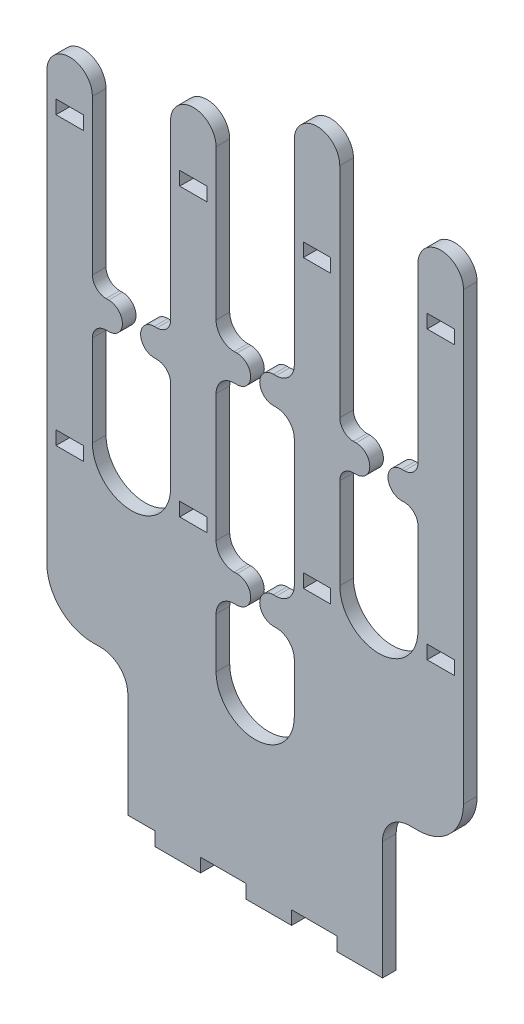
SolidWorks part; units mm, degrees
ref_plane "Front Plane" through (0, 0, 0) normal (0, 0, 1) x (1, 0, 0)
ref_plane "Top Plane" through (0, 0, 0) normal (0, 1, 0) x (1, 0, 0)
ref_plane "Right Plane" through (0, 0, 0) normal (1, 0, 0) x (0, 0, -1)
sketch "Sketch1" plane through (0, 0, 0) normal (0, 0, 1) x (1, 0, 0)
  line L0 (0, 0) -> (-140, 0)
  line L1 (-140, 0) -> (-140, 130)
  line L2 (-170, 160) -> (-179, 160)
  line L6 (-93, 350) -> (-93, 450)
  line L7 (-43, 700) -> (-43, 535)
  line L14 (179, 160) -> (170, 160)
  line L15 (140, 130) -> (140, 0)
  line L16 (140, 0) -> (0, 0)
  line L17 (-229, 210) -> (-229, 680)
  line L19 (-179, 680) -> (-179, 510)
  line L20 (0, -370.316) -> (0, 1299.3214) construction
  line L22 (93, 750) -> (93, 510)
  line L23 (179, 350) -> (179, 450)
  line L24 (229, 700) -> (229, 210)
  line L25 (-164, 495) -> (-161, 495)
  line L26 (-161, 465) -> (-164, 465)
  line L27 (-179, 450) -> (-179, 350)
  line L28 (-136, 849.3239) -> (-136, 130) construction
  line L29 (-111, 465) -> (-108, 465)
  line L30 (-108, 495) -> (-111, 495)
  line L31 (-93, 510) -> (-93, 700)
  line L37 (43, 200) -> (43, 255)
  line L38 (-23, 515) -> (-20, 515)
  line L39 (-20, 485) -> (-23, 485)
  line L47 (43, 535) -> (43, 750)
  line L51 (20, 485) -> (23, 485)
  line L52 (23, 515) -> (20, 515)
  line L53 (-43, 465) -> (-43, 325)
  line L54 (-23, 305) -> (-20, 305)
  line L55 (-20, 275) -> (-23, 275)
  line L56 (23, 305) -> (20, 305)
  line L57 (20, 275) -> (23, 275)
  line L58 (-43, 255) -> (-43, 200)
  line L59 (43, 325) -> (43, 465)
  line L60 (161, 465) -> (164, 465)
  line L61 (164, 495) -> (161, 495)
  line L62 (136, 1022.604) -> (136, 213.0726) construction
  line L63 (111, 465) -> (108, 465)
  line L64 (108, 495) -> (111, 495)
  line L65 (93, 450) -> (93, 350)
  line L66 (179, 510) -> (179, 700)
  line L67 (189, 342.5) -> (219, 342.5)
  line L68 (189, 657.5) -> (219, 657.5)
  line L69 (189, 657.5) -> (189, 642.5)
  line L70 (189, 642.5) -> (219, 642.5)
  line L71 (219, 657.5) -> (219, 642.5)
  line L72 (189, 342.5) -> (189, 327.5)
  line L73 (189, 327.5) -> (219, 327.5)
  line L74 (219, 342.5) -> (219, 327.5)
  line L75 (53, 657.5) -> (53, 642.5)
  line L76 (83, 642.5) -> (53, 642.5)
  line L77 (83, 657.5) -> (83, 642.5)
  line L78 (83, 657.5) -> (53, 657.5)
  line L79 (53, 342.5) -> (53, 327.5)
  line L80 (83, 327.5) -> (53, 327.5)
  line L81 (83, 342.5) -> (83, 327.5)
  line L82 (83, 342.5) -> (53, 342.5)
  line L83 (-83, 342.5) -> (-53, 342.5)
  line L84 (-83, 342.5) -> (-83, 327.5)
  line L85 (-83, 327.5) -> (-53, 327.5)
  line L86 (-53, 342.5) -> (-53, 327.5)
  line L87 (-83, 657.5) -> (-53, 657.5)
  line L88 (-83, 657.5) -> (-83, 642.5)
  line L89 (-83, 642.5) -> (-53, 642.5)
  line L90 (-53, 657.5) -> (-53, 642.5)
  line L91 (-219, 657.5) -> (-219, 642.5)
  line L92 (-189, 642.5) -> (-219, 642.5)
  line L93 (-189, 657.5) -> (-189, 642.5)
  line L94 (-189, 657.5) -> (-219, 657.5)
  line L95 (-219, 342.5) -> (-219, 327.5)
  line L96 (-189, 327.5) -> (-219, 327.5)
  line L97 (-189, 342.5) -> (-189, 327.5)
  line L98 (-189, 342.5) -> (-219, 342.5)
  arc A0 (-140, 130) -> (-170, 160) centre (-170, 130) ccw
  arc A7 (-93, 700) -> (-43, 700) centre (-68, 700) cw
  arc A8 (-43, 200) -> (43, 200) centre (0, 200) ccw
  arc A19 (170, 160) -> (140, 130) centre (170, 130) ccw
  arc A20 (-229, 210) -> (-179, 160) centre (-179, 210) ccw
  arc A21 (-229, 680) -> (-179, 680) centre (-204, 680) cw
  arc A23 (-179, 350) -> (-93, 350) centre (-136, 350) ccw
  arc A24 (43, 750) -> (93, 750) centre (68, 750) cw
  arc A25 (93, 350) -> (179, 350) centre (136, 350) ccw
  arc A26 (179, 700) -> (229, 700) centre (204, 700) cw
  arc A27 (229, 210) -> (179, 160) centre (179, 210) cw
  arc A28 (-179, 510) -> (-164, 495) centre (-164, 510) ccw
  arc A29 (-161, 495) -> (-161, 465) centre (-161, 480) cw
  arc A30 (-164, 465) -> (-179, 450) centre (-164, 450) ccw
  arc A31 (-108, 465) -> (-93, 450) centre (-108, 450) cw
  arc A32 (-111, 495) -> (-111, 465) centre (-111, 480) ccw
  arc A33 (-93, 510) -> (-108, 495) centre (-108, 510) cw
  arc A40 (-43, 535) -> (-23, 515) centre (-23, 535) ccw
  arc A41 (-20, 515) -> (-20, 485) centre (-20, 500) cw
  arc A42 (-23, 485) -> (-43, 465) centre (-23, 465) ccw
  arc A52 (23, 485) -> (43, 465) centre (23, 465) cw
  arc A53 (20, 515) -> (20, 485) centre (20, 500) ccw
  arc A54 (43, 535) -> (23, 515) centre (23, 535) cw
  arc A55 (-43, 325) -> (-23, 305) centre (-23, 325) ccw
  arc A56 (-20, 305) -> (-20, 275) centre (-20, 290) cw
  arc A57 (-23, 275) -> (-43, 255) centre (-23, 255) ccw
  arc A58 (43, 325) -> (23, 305) centre (23, 325) cw
  arc A59 (20, 305) -> (20, 275) centre (20, 290) ccw
  arc A60 (23, 275) -> (43, 255) centre (23, 255) cw
  arc A61 (164, 465) -> (179, 450) centre (164, 450) cw
  arc A62 (161, 495) -> (161, 465) centre (161, 480) ccw
  arc A63 (179, 510) -> (164, 495) centre (164, 510) cw
  arc A64 (108, 465) -> (93, 450) centre (108, 450) ccw
  arc A65 (111, 495) -> (111, 465) centre (111, 480) cw
  arc A66 (93, 510) -> (108, 495) centre (108, 510) ccw
  point P119 (204, 657.5)
  point P120 (189, 650)
extrude "Boss-Extrude1" add sketch "Sketch1" along normal blind 15
sketch "Sketch2" plane through (0, 0, 15) normal (0, 0, 1) x (1, 0, 0)
  line L0 (-140, 0) -> (140, 0) construction
  line L2 (-110, 0) -> (-110, 15)
  line L4 (-60, 0) -> (-60, 15)
  line L5 (-140, 130) -> (-140, 0) construction
  line L6 (-140, 15) -> (-110, 15)
  line L8 (-10, 0) -> (-10, 15)
  line L10 (40, 0) -> (40, 15)
  line L12 (90, 0) -> (90, 15)
  line L15 (-140, 0) -> (-110, 0)
  line L17 (-60, 0) -> (-10, 0)
  line L18 (-60, 15) -> (-10, 15)
  line L19 (40, 15) -> (90, 15)
  line L20 (40, 0) -> (90, 0)
  line L23 (-140, 15) -> (-140, 0)
  line L25 (140, 0) -> (140, 15)
extrude "Cut-Extrude1" cut sketch "Sketch2" against normal blind 15
equation "\"bacacho\"= 43"
equation "\"rama\"= 50"
equation "\"D16@Sketch1\"=\"bacacho\""
equation "\"D4@Sketch1\"=\"bacacho\""
equation "\"D3@Sketch1\"=\"bacacho\""
equation "\"D36@Sketch1\"=\"rama\""
equation "\"mdf\"= 15"
equation "\"base largo\"= ( \"rama\" * 2.80 )"
equation "\"D1@Sketch1\"=\"base largo\""
equation "\"D2@Sketch1\"=\"base largo\""
equation "\"D5@Sketch1\"=\"rama\""
equation "\"D7@Sketch1\"=\"rama\""
equation "\"D15@Sketch1\"=\"rama\""
equation "\"D17@Sketch1\"=\"rama\""
equation "\"altura\"= 700"
equation "\"D6@Sketch1\"=\"altura\""
equation "\"D22@Sketch1\"=\"altura\""
equation "\"D21@Sketch1\"=\"altura\"+50"
equation "\"680@Sketch1\"=\"altura\"-20"
equation "\"D1@Boss-Extrude1\"=\"mdf\""
equation "\"D3@Sketch2\"=\"mdf\""
equation "\"D2@Sketch2\"=\"rama\""
equation "\"D5@Sketch2\"=\"rama\""
equation "\"D1@Cut-Extrude1\"=\"mdf\""
